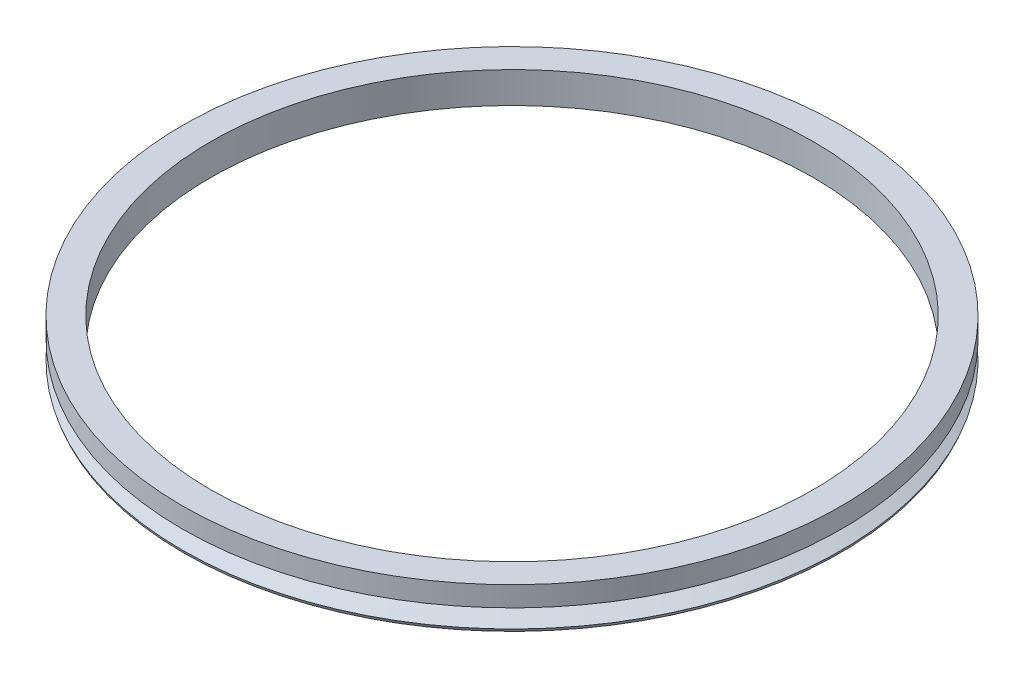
SolidWorks part; units mm, degrees
ref_plane "Front Plane" through (0, 0, 0) normal (0, 0, 1) x (1, 0, 0)
ref_plane "Top Plane" through (0, 0, 0) normal (0, 1, 0) x (1, 0, 0)
ref_plane "Right Plane" through (0, 0, 0) normal (1, 0, 0) x (0, 0, -1)
sketch "Sketch1" plane through (0, 0, 0) normal (0, 0, 1) x (1, 0, 0)
  line L0 (0, 0) -> (0, 10.414) construction
  line L1 (83.312, 10.414) -> (76.2, 10.414)
  line L2 (76.2, 10.414) -> (76.2, 2.54)
  line L3 (76.2, 2.54) -> (83.047, 0)
  line L8 (83.047, 0) -> (83.312, 0.7144)
  line L9 (83.312, 0.7144) -> (78.232, 3.302)
  line L10 (78.232, 3.302) -> (83.312, 5.334)
  line L11 (83.312, 5.334) -> (83.312, 10.414)
  line L12 (76.2, 2.54) -> (78.232, 2.54) construction
  line L13 (78.232, 2.54) -> (78.232, 3.302) construction
  dimension "D1" = 152.4
  dimension "D2" = 10.414
  dimension "D3" = 7.112
  dimension "D4" = 7.874
  dimension "D5" = 5.08
  dimension "D6" = 0.762
  dimension "D7" = 2.032
revolve "Revolve1" add sketch "Sketch1" angle 360 about L0
